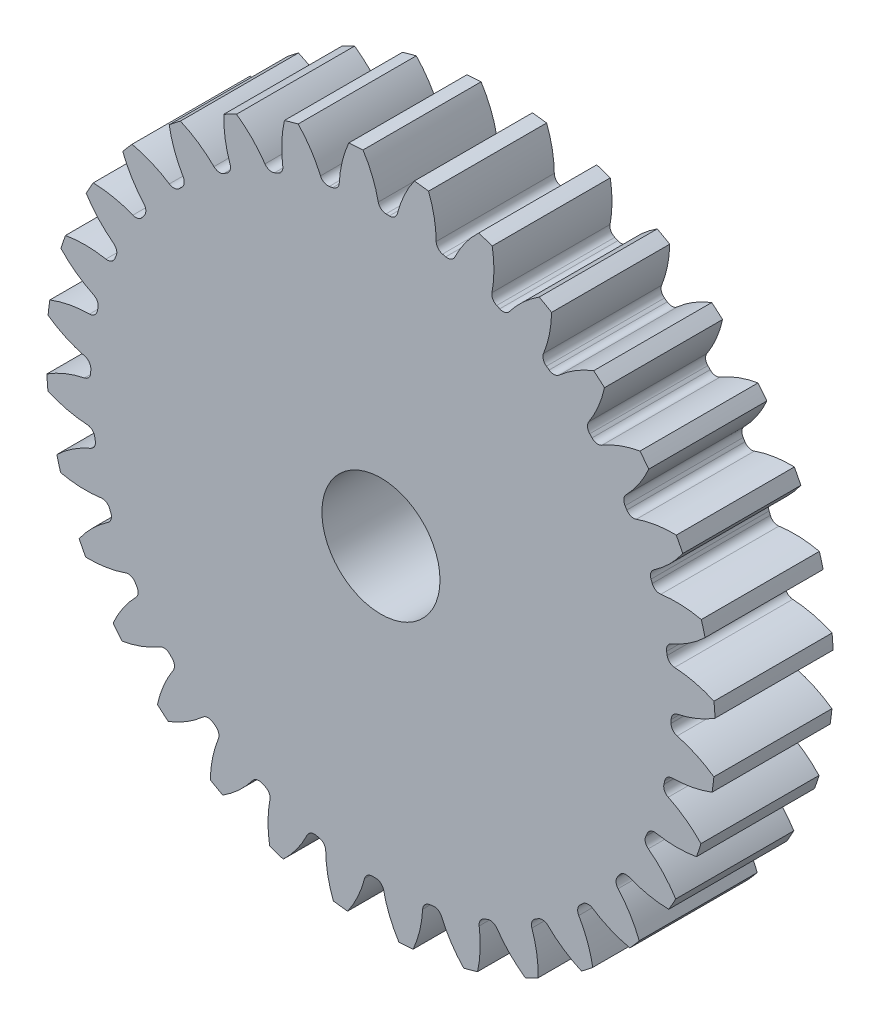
SolidWorks part; units mm, degrees
ref_plane "Front" through (0, 0, 0) normal (0, 0, 1) x (1, 0, 0)
ref_plane "Top" through (0, 0, 0) normal (0, 1, 0) x (1, 0, 0)
ref_plane "Right" through (0, 0, 0) normal (1, 0, 0) x (0, 0, -1)
sketch "Sketch3" plane through (0, 0, 0) normal (0, 0, 1) x (1, 0, 0)
  circle A0 centre (0, 0) radius 287.8667
  dimension "od" = 575.7333
extrude "gearBody" add sketch "Sketch3" along normal blind 101.6
sketch "Sketch2" plane through (0, 0, 0) normal (0, 0, 1) x (1, 0, 0)
  line L0 (0, 0) -> (235.2142, 97.4289) construction
  line L1 (286.8322, -29.0094) -> (0, 0) construction
  line L2 (0, 0) -> (36.3143, 0) construction
  line L3 (270.8432, 6.9877) -> (270.2305, -19.5019) construction
  line L5 (270.5369, -6.2571) -> (0, 0) construction
  line L7 (0, 0) -> (254.5941, 0) construction
  arc A0 (254.5848, 2.1723) -> (254.2121, -13.94) centre (0, 0) ccw construction
  arc A1 (287.4517, 15.4515) -> (286.43, -28.7246) centre (0, 0) ccw construction
  arc A2 (270.8432, 6.9877) -> (270.2305, -19.5019) centre (0, 0) ccw construction
  arc A3 (249.6621, -7.225) -> (249.7292, -4.3252) centre (0, 0) ccw
  arc A4 (286.8322, -29.0094) -> (254.8236, -14.0962) centre (230.4584, -108.1992) ccw
  arc A5 (286.8322, -29.0094) -> (287.8667, 15.7174) centre (0, 0) ccw
  arc A6 (287.8667, 15.7174) -> (255.2029, 2.3001) centre (235.2142, 97.4289) cw
  arc A7 (249.7292, -4.3252) -> (255.2029, 2.3001) centre (256.62, -4.4445) cw
  arc A8 (254.8236, -14.0962) -> (249.6621, -7.225) centre (256.5511, -7.4244) cw
  point P6 (287.8667, 15.7174)
  point P22 (286.8322, -29.0094)
  dimension "baseDia" = 509.1881
  dimension "od" = 575.7333
  dimension "pd" = 541.8667
  dimension "rd" = 499.5333
  dimension "rFillet" = 6.8919
  dimension "pointX" = 287.8667
  dimension "pointY" = 15.7174
  dimension "CTT" = 26.4896
  dimension "flankCenterAngle" = 22.5
extrude "toothCut" cut sketch "Sketch2" along normal through all
pattern_circular "CirPattern1" count 32 over 360 about axis through (0, 0, 0) along (0, 0, 1) of "toothCut"
sketch "hub1Dia" plane through (0, 0, 0) normal (0, 0, -1) x (-1, 0, 0)
  circle A0 centre (0, 0) radius 12.7
  dimension "hub1Dia" = 25.4
sketch "hub2Dia" plane through (0, 0, 101.6) normal (0, 0, 1) x (1, 0, 0)
  circle A0 centre (0, 0) radius 12.7
  dimension "hub2dia" = 25.4
sketch "boreDia" plane through (0, 0, 0) normal (0, 0, 1) x (1, 0, 0)
  circle A0 centre (0, 0) radius 50.8
  dimension "boreDia" = 101.6
extrude "bore" cut sketch "boreDia" against normal mid plane 25400
